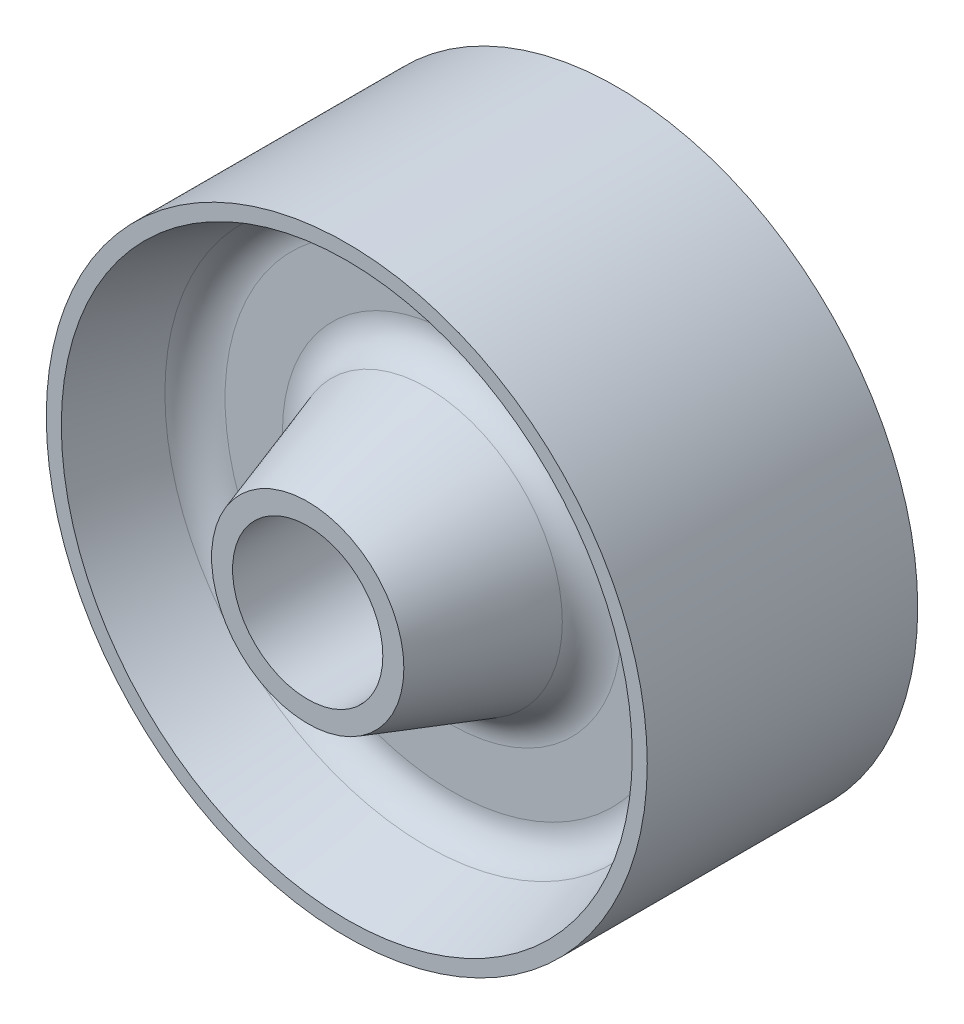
SolidWorks part; units mm, degrees
ref_plane "Front Plane" through (0, 0, 0) normal (0, 0, 1) x (1, 0, 0)
ref_plane "Top Plane" through (0, 0, 0) normal (0, 1, 0) x (1, 0, 0)
ref_plane "Right Plane" through (0, 0, 0) normal (1, 0, 0) x (0, 0, -1)
sketch "Sketch1" plane through (0, 0, 0) normal (1, 0, 0) x (0, 0, -1)
  line L0 (0, 42.8674) -> (0, -20.3907) construction
  line L1 (-41.4444, 0) -> (35.5536, 0) construction
  line L2 (-22.5, 50) -> (22.5, 50)
  line L3 (22.5, 50) -> (22.5, 47.5)
  line L4 (22.5, 47.5) -> (9.2643, 43.5)
  line L5 (5, 37.7566) -> (5, 28.2025)
  line L6 (9.1342, 22.5) -> (29, 16)
  line L8 (29, 16) -> (29, 12.5)
  line L9 (29, 12.5) -> (-29, 12.5)
  line L10 (-29, 12.5) -> (-29, 16)
  line L12 (-29, 16) -> (-9.1342, 22.5)
  line L13 (-5, 28.2025) -> (-5, 37.7566)
  line L14 (-9.2643, 43.5) -> (-22.5, 47.5)
  line L15 (-22.5, 47.5) -> (-22.5, 50)
  arc A0 (5, 37.7566) -> (9.2643, 43.5) centre (11, 37.7566) cw
  arc A1 (-5, 37.7566) -> (-9.2643, 43.5) centre (-11, 37.7566) ccw
  arc A2 (9.1342, 22.5) -> (5, 28.2025) centre (11, 28.2025) cw
  arc A3 (-5, 28.2025) -> (-9.1342, 22.5) centre (-11, 28.2025) cw
  dimension "D4" = 6
  dimension "D5" = 6
  dimension "D1" = 22.5
  dimension "D2" = 22.5
  dimension "D3" = 29
  dimension "D6" = 29
  dimension "D7" = 5
  dimension "D8" = 5
  dimension "D9" = 43.5
  dimension "D10" = 43.5
  dimension "D11" = 22.5
  dimension "D12" = 22.5
  dimension "D13" = 16
  dimension "D14" = 16
  dimension "D15" = 12.5
  dimension "D16" = 47.5
  dimension "D17" = 47.5
  dimension "D18" = 50
revolve "Revolve1" add sketch "Sketch1" angle 360 about L1
